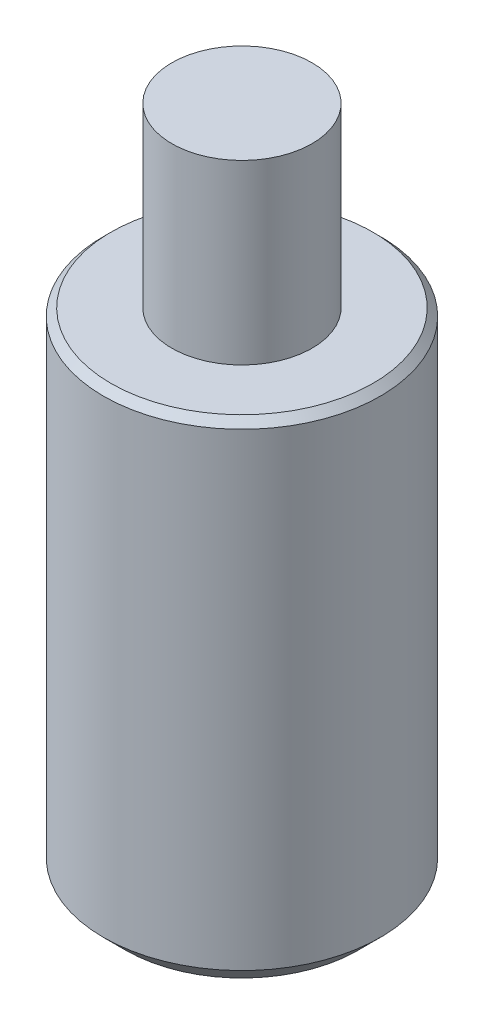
SolidWorks part; units mm, degrees
ref_plane "Front Plane" through (0, 0, 0) normal (0, 0, 1) x (1, 0, 0)
ref_plane "Top Plane" through (0, 0, 0) normal (0, 1, 0) x (1, 0, 0)
ref_plane "Right Plane" through (0, 0, 0) normal (1, 0, 0) x (0, 0, -1)
sketch "Sketch1" plane through (0, 0, 0) normal (0, 1, 0) x (1, 0, 0)
  circle A0 centre (0, 0) radius 4.7625
  dimension "D1" = 9.525
extrude "Extrude1" add sketch "Sketch1" along normal blind 17.145
sketch "Sketch2" plane through (0, 17.145, 0) normal (0, 1, 0) x (1, 0, 0)
  circle A0 centre (0, 0) radius 2.413
  dimension "D1" = 4.826
extrude "Extrude2" add sketch "Sketch2" along normal blind 6.096
chamfer "Chamfer1" distance 0.254 angle 45 1 edges at (0, 17.145, 4.7625)
sketch "Sketch3" plane through (0, 0, 0) normal (0, -1, 0) x (1, 0, 0)
  line L1 (1.3785, 2.3876) -> (-1.3785, 2.3876)
  line L2 (-1.3785, 2.3876) -> (-2.757, 0)
  line L3 (-2.757, 0) -> (-1.3785, -2.3876)
  line L4 (-1.3785, -2.3876) -> (1.3785, -2.3876)
  line L5 (1.3785, -2.3876) -> (2.757, 0)
  line L6 (2.757, 0) -> (1.3785, 2.3876)
  circle A0 centre (0, 0) radius 2.3876 construction
  dimension "D1" = 4.7752
extrude "Extrude3" cut sketch "Sketch3" against normal blind 3.175
chamfer "Chamfer2" distance 0.762 angle 45 1 edges at (0, 0, 4.7625)
